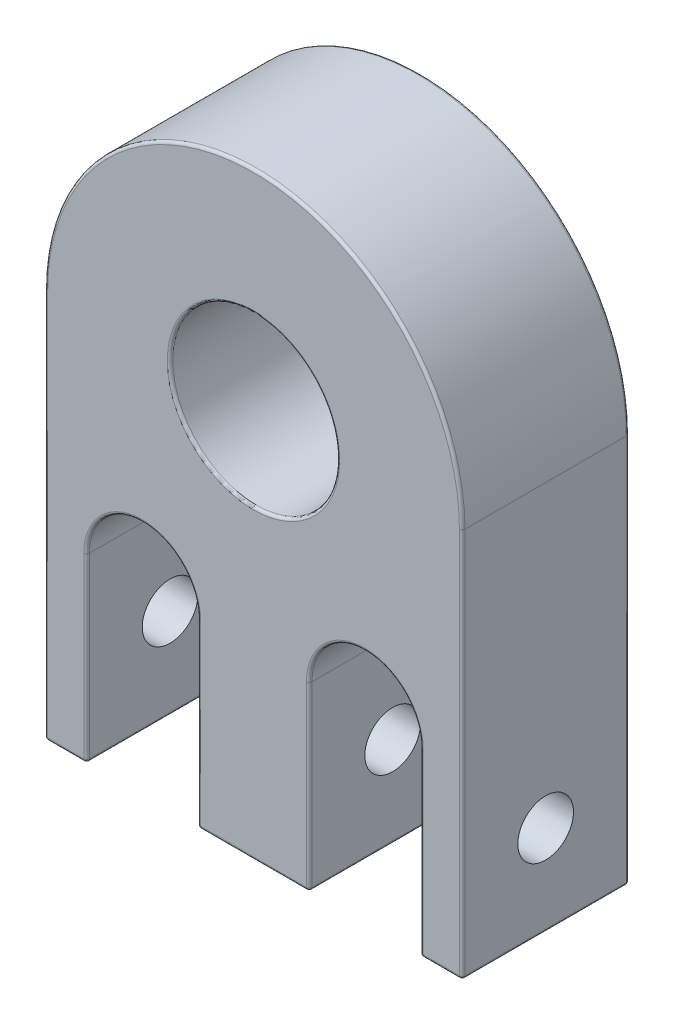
SolidWorks part; units mm, degrees
ref_plane "face" through (0, 0, 0) normal (0, 0, 1) x (1, 0, 0)
ref_plane "coté" through (0, 0, 0) normal (0, 1, 0) x (1, 0, 0)
ref_plane "dessus" through (0, 0, 0) normal (1, 0, 0) x (0, 0, -1)
sketch "Esquisse1" plane through (0, 0, 0) normal (0, 0, 1) x (1, 0, 0)
  line L0 (0, 0) -> (0, 28)
  line L1 (0, 0) -> (3, 0)
  line L2 (30, 0) -> (30, 28)
  line L3 (3, 0) -> (3, 13)
  line L4 (11, 0) -> (11, 13)
  line L5 (15, 28) -> (15, -2) construction
  line L6 (19, 0) -> (19, 13)
  line L7 (27, 0) -> (27, 13)
  line L8 (11, 0) -> (19, 0)
  line L9 (27, 0) -> (30, 0)
  arc A0 (0, 28) -> (30, 28) centre (15, 28) cw
  arc A1 (3, 13) -> (11, 13) centre (7, 13) cw
  arc A2 (27, 13) -> (19, 13) centre (23, 13) ccw
  circle A3 centre (15, 28) radius 6
  dimension "D6" = 12
  dimension "D1" = 30
  dimension "D2" = 28
  dimension "D3" = 8
  dimension "D4" = 13
  dimension "D5" = 7
extrude "Base-Extrusion" add sketch "Esquisse1" along normal blind 12
sketch "Esquisse2" plane through (30, 0, 0) normal (1, 0, 0) x (0, 0, -1)
  line L0 (-12, 0) -> (0, 0) construction
  line L1 (-12, 0) -> (-12, 28) construction
  circle A0 centre (-6, 6.5) radius 2
  dimension "D1" = 4
  dimension "D2" = 6.5
  dimension "D3" = 6
extrude "Enlèv. mat.-Extru.1" cut sketch "Esquisse2" against normal through all
fillet "Congé1" radius 0.2
